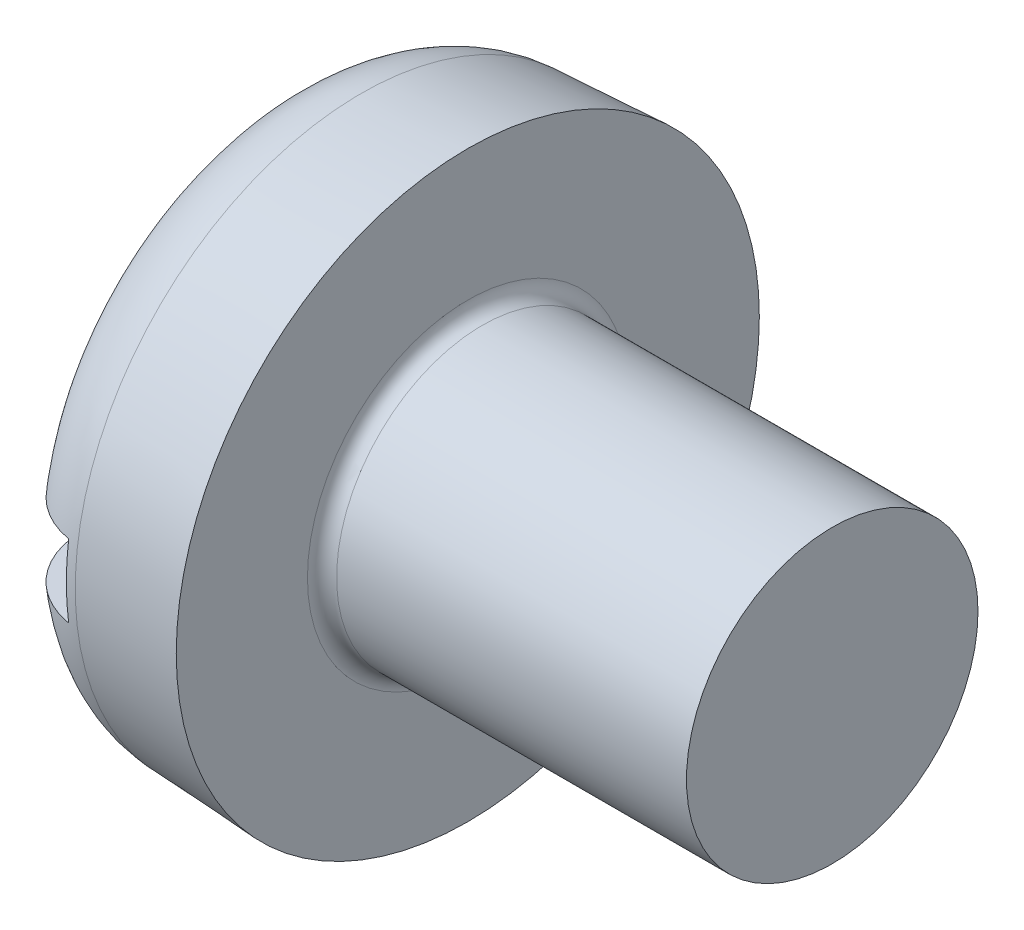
SolidWorks part; units mm, degrees
ref_plane "Front" through (0, 0, 0) normal (0, 0, 1) x (1, 0, 0)
ref_plane "Top" through (0, 0, 0) normal (0, 1, 0) x (1, 0, 0)
ref_plane "Right" through (0, 0, 0) normal (1, 0, 0) x (0, 0, -1)
other "Configuration Table"
ref_plane "Plane1" through (1.3, 0, 0) normal (1, 0, 0) x (0, 0, -1)
sketch "Sketch1" plane through (1.3, 0, 0) normal (1, 0, 0) x (0, 0, -1)
  circle A0 centre (0, 0) radius 2
  dimension "dk" = 4
extrude "BaseHead" add sketch "Sketch1" against normal blind 1.3 draft 3
sketch "Sketch2" plane through (1.3, 0, 0) normal (1, 0, 0) x (0, 0, -1)
  line L0 (0, 0) -> (0.8, 0) construction
  circle A0 centre (0, 0) radius 1
extrude "BaseBody" add sketch "Sketch2" along normal blind 2.5
fillet "HeadFillet2" radius 0.6 1 edges at (0, 0, -1.9319)
sketch "Sketch3" plane through (1.05, -1.05, 0) normal (0, 0, 1) x (0, -1, 0)
  line L1 (-1.3, -0.55) -> (-0.8, -0.55)
  line L2 (-1.3, -0.55) -> (-1.3, -1.05)
  line L3 (-1.3, -1.05) -> (-0.8, -1.05)
  line L4 (-0.8, -0.55) -> (-0.8, -1.05)
  line L5 (-2.4125, -1.05) -> (0.3125, -1.05) construction
extrude "Notch" cut sketch "Sketch3" against normal through all and the other way through all
fillet "HeadFillet1" radius 0.1 1 edges at (1.3, 0, -1)
sketch "Sketch4" plane through (0, 0, 0) normal (0, 0, 1) x (1, 0, 0)
  line L0 (-34.7, 5.7835) -> (-34.7, 1)
  line L1 (1.3, 5.7835) -> (-34.7, 5.7835)
  line L2 (1.3, 5.7835) -> (1.3, 0.7835)
  line L3 (1.3, 0.7835) -> (-37.9, 0.7835)
  line L6 (6.4188, 0) -> (-0.5067, 0) construction
  line L8 (3.8, -1) -> (3.8, 1) construction
  line L9 (-34.7, 1) -> (-37.9, 0.7835)
  line L11 (1.3, -2) -> (1.3, 2) construction
  line L12 (3.8, 1) -> (1.4, 1) construction
  dimension "dd" = 5
  dimension "b1" = 1.567
  dimension "b" = 38.5
  dimension "x" = 3.2
sketch "Sketch5" plane through (0, 0, 0) normal (0, 0, 1) x (1, 0, 0)
  line L0 (3.8, 0.8125) -> (3.9083, 1)
  line L1 (3.9083, 1) -> (3.9083, 1.2165)
  line L2 (3.9083, 1.2165) -> (3.6917, 1.2165)
  line L3 (3.6917, 1.2165) -> (3.6917, 1)
  line L4 (3.6917, 1) -> (3.8, 0.8125)
  line L5 (0, 0) -> (4.296, 0) construction
  line L6 (3.8, -1) -> (3.8, 1) construction
revolve "Cut-Revolve10" [suppressed] cut sketch "Sketch5" angle 360 about L5
pattern_linear "LPattern10" [suppressed] count 7 spacing 0.2598 along (1, 0, 0)
equation "\"m@Sketch3\" = \"n@Sketch3\" / 2"
equation "\"D1@Plane1\" = \"k@BaseHead\""
equation "\"D1@Sketch5\" = \"d@Sketch2\""
equation "\"D2@Sketch5\" =  ( \"d@Sketch2\" - \"D2@ThreadCosmetic1\" )  / 2"
equation "\"D3@LPattern10\" = \"D2@Sketch5\" * 1.2"
equation "\"D1@LPattern10\" = \"D1@ThreadCosmetic1\" / \"D3@LPattern10\" "
